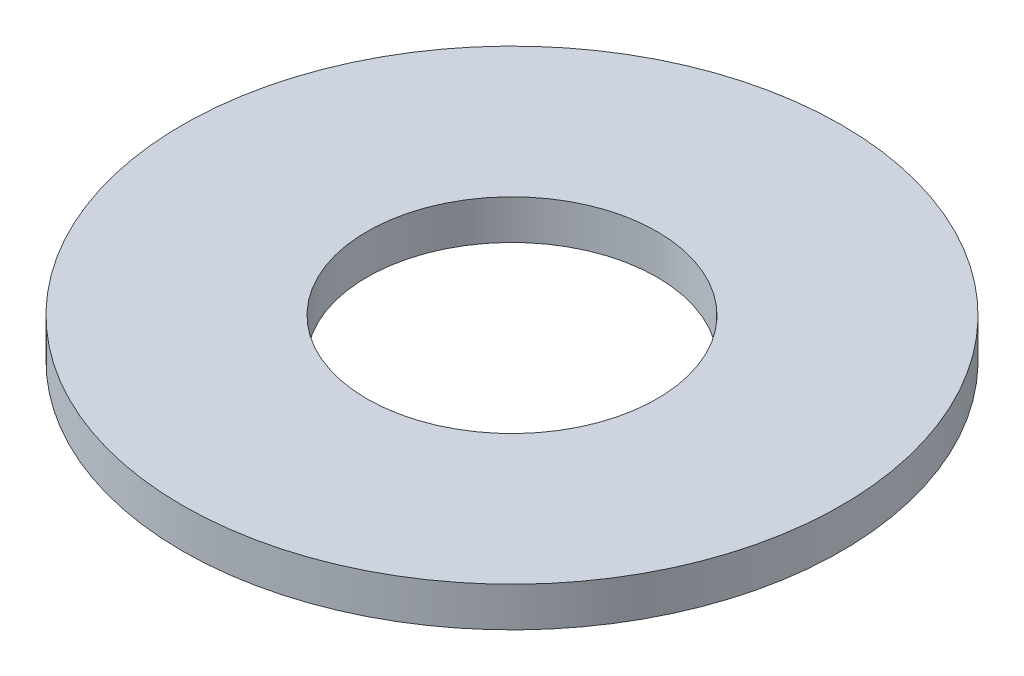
SolidWorks part; units mm, degrees
ref_plane "Front" through (0, 0, 0) normal (0, 0, 1) x (1, 0, 0)
ref_plane "Top" through (0, 0, 0) normal (0, 1, 0) x (1, 0, 0)
ref_plane "Right" through (0, 0, 0) normal (1, 0, 0) x (0, 0, -1)
sketch "Sketch1" plane through (0, 0, 0) normal (0, 1, 0) x (1, 0, 0)
  circle A0 centre (0, 0) radius 1.1
  circle A1 centre (0, 0) radius 2.5
extrude "Extrude1" add sketch "Sketch1" along normal blind 0.3
